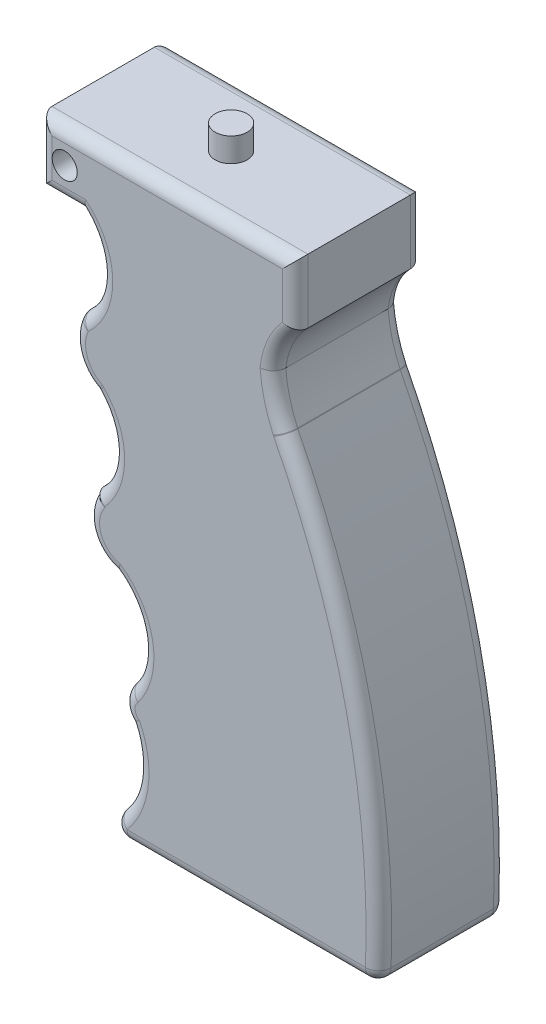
SolidWorks part; units mm, degrees
ref_plane "Front Plane" through (0, 0, 0) normal (0, 0, 1) x (1, 0, 0)
ref_plane "Top Plane" through (0, 0, 0) normal (0, 1, 0) x (1, 0, 0)
ref_plane "Right Plane" through (0, 0, 0) normal (1, 0, 0) x (0, 0, -1)
sketch "Sketch1" plane through (0, 0, 0) normal (0, 0, 1) x (1, 0, 0)
  line L0 (-38.1, 58.42) -> (12.7, 58.42)
  line L1 (29.0848, -58.42) -> (-28.1138, -58.42)
  line L2 (10.6467, 27.5019) -> (10.6928, 27.4009)
  line L7 (12.7, 58.42) -> (12.7, 45.72)
  line L9 (-38.1, 58.42) -> (-38.1, 45.72)
  line L10 (-38.1, 45.72) -> (-29.8174, 45.72)
  line L11 (-27.0979, 16.0506) -> (-27.1052, 16.0581)
  line L12 (-27.539, -1.9361) -> (-27.539, -1.4804)
  line L13 (-30.3583, 27.4874) -> (-30.3775, 27.4711)
  arc A0 (12.7, 45.72) -> (8.2926, 36.6588) centre (23.361, 34.9321) ccw
  arc A1 (8.2926, 36.6588) -> (10.6467, 27.5019) centre (35.5554, 38.7866) ccw
  arc A3 (-29.8174, 45.72) -> (-30.3583, 27.4874) centre (-38.3044, 36.8475) cw
  arc A4 (-27.1052, 16.0581) -> (-30.3775, 27.4711) centre (-23.0348, 23.4008) cw
  arc A5 (10.6928, 27.4009) -> (29.0848, -58.42) centre (-139.3467, -49.6349) cw
  arc A6 (-27.539, -1.9361) -> (-23.0582, -13.2522) centre (-21.0202, -5.9001) ccw
  arc A7 (-23.0582, -13.2522) -> (-20.3994, -31.279) centre (-30.7422, -23.595) cw
  arc A8 (-20.3994, -31.279) -> (-20.2481, -37.4635) centre (-17.2315, -34.2956) ccw
  arc A9 (-20.2481, -37.4635) -> (-28.1138, -58.42) centre (-34.6592, -44.0089) cw
  arc A10 (-27.0979, 16.0506) -> (-27.539, -1.4804) centre (-36.0222, 7.5041) cw
  point P0 (0, 0)
  dimension "D3" = 50.8
  dimension "D4" = 12.7
extrude "Boss-Extrude2" add sketch "Sketch1" along normal blind 25.4
sketch "Sketch2" plane through (0, 58.42, 0) normal (0, 1, 0) x (1, 0, 0)
  circle A0 centre (-12.7, -12.7) radius 3.175
  dimension "D1" = 6.35
extrude "Boss-Extrude3" add sketch "Sketch2" along normal blind 4.7625
fillet "Fillet4" radius 2.54 20 edges at (-26.0317, 36.4833, 0) (-31.1051, 21.0869, 0) (-27.1016, 16.0543, 0) (-23.6695, 7.1932, 0) (-27.539, -1.7083, 0) (-28.1138, -8.7089, 0) (-17.9953, -21.715, 0) (-21.6046, -34.4026, 0) (-19.8407, -49.5708, 0) (0.4855, -58.42, 0) (25.5692, -14.2922, 0) (10.6697, 27.4514, 0) (9.0709, 31.9778, 0) (9.7218, 41.5661, 0) (12.7, 52.07, 0) (-12.7, 58.42, 0) (-38.1, 52.07, 0) (-33.9587, 45.72, 0) (-30.3679, 27.4793, 25.4) (-26.0317, 36.4833, 25.4)
fillet "Fillet1" radius 2.54 24 edges at (-12.7, 58.42, 25.4) (12.7, 52.07, 25.4) (9.7218, 41.5661, 25.4) (9.0709, 31.9778, 25.4) (10.6697, 27.4514, 25.4) (25.5692, -14.2922, 25.4) (0.4855, -58.42, 25.4) (-19.8407, -49.5708, 25.4) (-21.6046, -34.4026, 25.4) (-17.9953, -21.715, 25.4) (-28.1138, -8.7089, 25.4) (-27.539, -1.7083, 25.4) (-23.6695, 7.1932, 25.4) (-27.1016, 16.0543, 25.4) (-32.2681, 45.72, 25.4) (-38.1, 52.07, 25.4) (-29.4516, 26.7276, 0.4028) (-30.3775, 27.4711, 12.7) (-30.2304, 19.0757, 25.4) (-30.667, 26.8983, 23.9587) (28.7633, -58.0816, 1.2733) (-27.9518, -58.3845, 2.1169) (29.0848, -58.42, 13.97) (-28.1138, -58.42, 13.97)
sketch "Sketch3" plane through (0, 0, 25.4) normal (0, 0, 1) x (1, 0, 0)
  line L0 (-38.1, 52.07) -> (-33.02, 52.07) construction
  line L1 (-38.1, 45.72) -> (-38.1, 58.42) construction
  circle A0 centre (-33.02, 52.07) radius 2.4892
extrude "Cut-Extrude1" cut sketch "Sketch3" against normal blind 25.4
